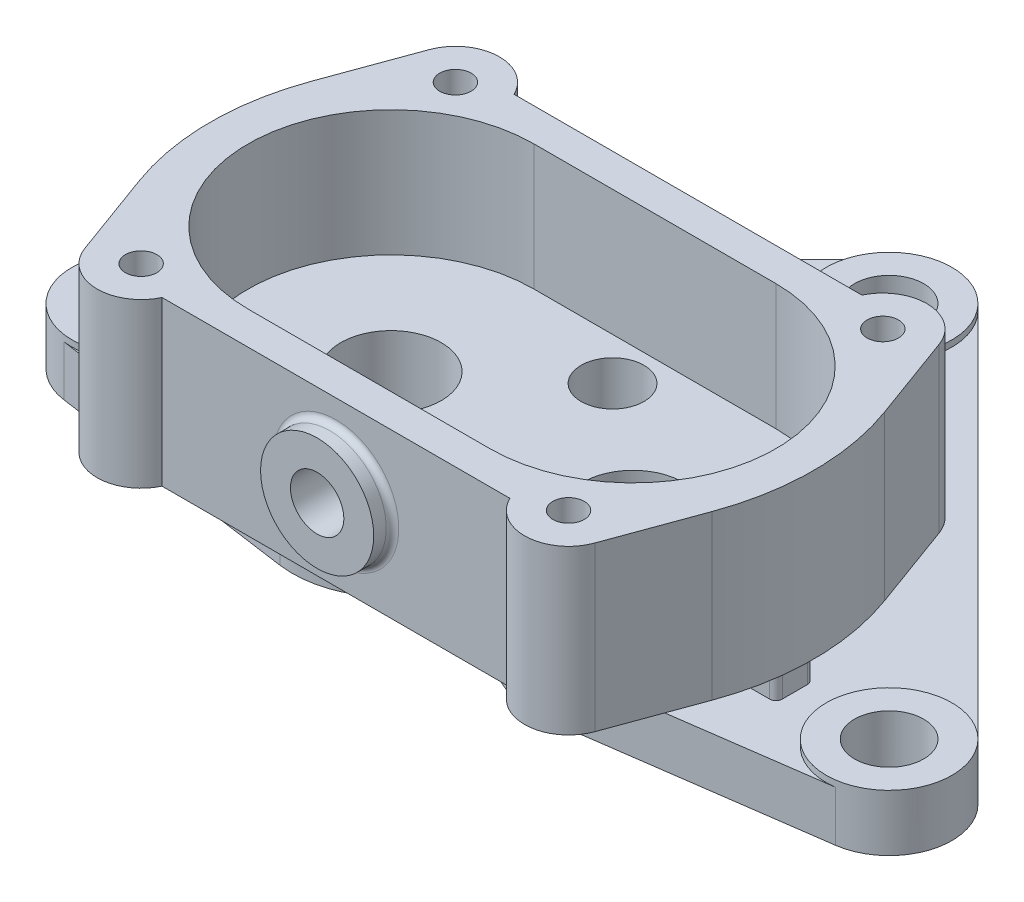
SolidWorks part; units mm, degrees
ref_plane "前视" through (0, 0, 0) normal (0, 0, 1) x (1, 0, 0)
ref_plane "上视" through (0, 0, 0) normal (0, 1, 0) x (1, 0, 0)
ref_plane "右视" through (0, 0, 0) normal (1, 0, 0) x (0, 0, -1)
sketch "草图1" plane through (0, 0, 0) normal (0, 1, 0) x (1, 0, 0)
  line L0 (0, 0) -> (0, 38.1176) construction
  line L1 (-67.0711, -52.9289) -> (-7.0711, 7.0711)
  line L2 (67.0711, -52.9289) -> (7.0711, 7.0711)
  line L3 (-61.3892, -69.903) -> (-21.4257, -75.5093)
  line L4 (61.3892, -69.903) -> (21.4257, -75.5093)
  line L5 (-60, -60) -> (51.3345, -60) construction
  circle A0 centre (0, 0) radius 5.5
  circle A1 centre (-60, -60) radius 5.5
  circle A2 centre (60, -60) radius 5.5
  arc A3 (7.0711, 7.0711) -> (-7.0711, 7.0711) centre (0, 0) ccw
  arc A4 (-67.0711, -52.9289) -> (-61.3892, -69.903) centre (-60, -60) ccw
  arc A5 (61.3892, -69.903) -> (67.0711, -52.9289) centre (60, -60) ccw
  arc A6 (-21.4257, -75.5093) -> (-3.9163, -63.1862) centre (-19.25, -60) ccw
  arc A7 (21.4257, -75.5093) -> (3.9163, -63.1862) centre (19.25, -60) cw
  arc A8 (-3.9163, -63.1862) -> (3.9163, -63.1862) centre (0, -64) cw
  circle A9 centre (-19.25, -60) radius 8
  circle A10 centre (19.25, -60) radius 8
  circle A11 centre (0, -44) radius 5
  dimension "D1" = 11
  dimension "D4" = 10
  dimension "D6" = 4
  dimension "D7" = 16
  dimension "D8" = 10
  dimension "D2" = 120
  dimension "D3" = 60
  dimension "D5" = 38.5
  dimension "D9" = 16
extrude "拉伸1" add sketch "草图1" along normal blind 8
sketch "草图2" plane through (0, 8, 0) normal (0, 1, 0) x (-1, 0, 0)
  circle A0 centre (0, 0) radius 10
  circle A1 centre (60, 60) radius 10
  circle A2 centre (-60, 60) radius 10
  circle A3 centre (-60, 60) radius 5.5 construction
  arc A4 (-61.3892, 69.903) -> (-67.0711, 52.9289) centre (-60, 60) ccw construction
  arc A5 (-7.0711, -7.0711) -> (7.0711, -7.0711) centre (0, 0) ccw construction
  circle A6 centre (60, 60) radius 5.5 construction
  arc A7 (67.0711, 52.9289) -> (61.3892, 69.903) centre (60, 60) ccw construction
  circle A8 centre (0, 0) radius 5.5 construction
  circle A9 centre (-60, 60) radius 5.5
  circle A10 centre (0, 0) radius 5.5
  circle A11 centre (60, 60) radius 5.5
extrude "拉伸2" add sketch "草图2" along normal blind 1
sketch "草图3" plane through (0, 8, 0) normal (0, 1, 0) x (-1, 0, 0)
  line L0 (45.6756, 60) -> (-44.8138, 60) construction
  line L1 (35.4239, 57) -> (44, 57)
  line L2 (35.4239, 63) -> (44, 63)
  line L3 (0, 0) -> (0, 17.1644) construction
  line L4 (0, 120) -> (0, 102.8356) construction
  line L5 (45, 58) -> (45, 62)
  line L6 (-35.4239, 63) -> (-44, 63)
  line L7 (-35.4239, 57) -> (-44, 57)
  line L8 (-45, 58) -> (-45, 62)
  arc A0 (16.3823, 44.6036) -> (34.4532, 56.2401) centre (19.25, 60) ccw
  arc A1 (-3.9163, 63.1862) -> (-34.4532, 63.7599) centre (-19.25, 60) ccw
  arc A2 (21.4257, 75.5093) -> (3.9163, 63.1862) centre (19.25, 60) ccw construction
  arc A3 (-3.9163, 63.1862) -> (-21.4257, 75.5093) centre (-19.25, 60) ccw construction
  arc A4 (-3.9163, 63.1862) -> (3.9163, 63.1862) centre (0, 64) ccw construction
  arc A5 (-3.9163, 63.1862) -> (3.9163, 63.1862) centre (0, 64) ccw
  circle A6 centre (19.25, 60) radius 8
  circle A7 centre (-19.25, 60) radius 8
  circle A8 centre (0, 44) radius 5
  arc A9 (-11.7374, 41.5034) -> (11.7374, 41.5034) centre (0, 44) ccw
  arc A10 (16.3823, 44.6036) -> (11.7374, 41.5034) centre (15.6499, 40.6712) ccw
  arc A11 (-16.3823, 44.6036) -> (-11.7374, 41.5034) centre (-15.6499, 40.6712) cw
  arc A12 (34.4532, 63.7599) -> (3.9163, 63.1862) centre (19.25, 60) ccw
  arc A13 (-34.4532, 56.2401) -> (-16.3823, 44.6036) centre (-19.25, 60) ccw
  arc A14 (45, 58) -> (44, 57) centre (44, 58) cw
  arc A15 (45, 62) -> (44, 63) centre (44, 62) ccw
  arc A16 (-45, 58) -> (-44, 57) centre (-44, 58) ccw
  arc A17 (-45, 62) -> (-44, 63) centre (-44, 62) cw
  arc A18 (-34.4532, 56.2401) -> (-35.4239, 57) centre (-35.4239, 56) ccw
  arc A19 (-34.4532, 63.7599) -> (-35.4239, 63) centre (-35.4239, 64) cw
  arc A20 (34.4532, 56.2401) -> (35.4239, 57) centre (35.4239, 56) cw
  arc A21 (34.4532, 63.7599) -> (35.4239, 63) centre (35.4239, 64) ccw
  point P38 (45, 57)
  point P41 (45, 63)
  point P44 (-45, 57)
  point P47 (-45, 63)
  point P50 (-34.6212, 57)
  point P53 (-34.6212, 63)
  point P56 (34.6212, 57)
  point P59 (34.6212, 63)
  dimension "D1" = 16
  dimension "D2" = 10
  dimension "D4" = 4
  dimension "D5" = 12
  dimension "D8" = 1
  dimension "D3" = 16
  dimension "D6" = 6
  dimension "D7" = 90
extrude "拉伸3" add sketch "草图3" along normal blind 6
sketch "草图4" plane through (0, 14, 0) normal (0, 1, 0) x (-1, 0, 0)
  line L0 (24.1305, 60) -> (-36.8421, 60) construction
  line L1 (-44, 57) -> (-35.4239, 57) construction
  line L2 (-35.4239, 63) -> (-44, 63) construction
  line L3 (45.5713, 46.2741) -> (40.575, 32.598)
  line L4 (45.5713, 73.7259) -> (40.575, 87.402)
  line L5 (0, 0) -> (0, 19.1495) construction
  line L6 (-45.5713, 73.7259) -> (-40.575, 87.402)
  line L7 (27.6754, 32) -> (-27.6754, 32)
  line L8 (27.6754, 88) -> (-27.6754, 88)
  line L9 (-45.5713, 46.2741) -> (-40.575, 32.598)
  arc A0 (45.5713, 46.2741) -> (45.5713, 73.7259) centre (8, 60) ccw
  arc A1 (-45.5713, 46.2741) -> (-45.5713, 73.7259) centre (-8, 60) cw
  circle A2 centre (0, 44) radius 5 construction
  circle A3 centre (-19.25, 60) radius 8 construction
  arc A4 (40.575, 87.402) -> (27.6754, 88) centre (34, 85) ccw
  arc A5 (-27.6754, 88) -> (-40.575, 87.402) centre (-34, 85) ccw
  arc A6 (-27.6754, 32) -> (-40.575, 32.598) centre (-34, 35) cw
  arc A7 (40.575, 32.598) -> (27.6754, 32) centre (34, 35) cw
  circle A8 centre (19.25, 60) radius 8 construction
  circle A9 centre (0, 44) radius 5
  circle A10 centre (-19.25, 60) radius 8
  circle A11 centre (19.25, 60) radius 8
  dimension "D4" = 40
  dimension "D5" = 7
  dimension "D1" = 56
  dimension "D2" = 50
  dimension "D3" = 68
  dimension "D6" = 16
extrude "拉伸4" add sketch "草图4" along normal blind 26
sketch "草图5" plane through (0, 40, 0) normal (0, 1, 0) x (-1, 0, 0)
  line L0 (19.25, 37.25) -> (-19.25, 37.25)
  line L1 (-19.25, 60) -> (19.25, 60) construction
  line L2 (19.25, 82.75) -> (-19.25, 82.75)
  arc A0 (19.25, 37.25) -> (19.25, 82.75) centre (19.25, 60) ccw
  arc A1 (-19.25, 82.75) -> (-19.25, 37.25) centre (-19.25, 60) ccw
  circle A2 centre (-19.25, 60) radius 8 construction
  circle A3 centre (19.25, 60) radius 8 construction
  dimension "D2" = 22.75
extrude "切除-拉伸1" cut sketch "草图5" against normal blind 20
sketch "草图6" plane through (0, 0, 88) normal (0, 0, 1) x (1, 0, 0)
  line L0 (0, 20) -> (0, 0) construction
  circle A0 centre (0, 27) radius 9
  dimension "D1" = 18
  dimension "D2" = 27
extrude "拉伸5" add sketch "草图6" along normal blind 3
hole_wizard "M10x1.5 螺纹孔1" positions "草图8" profile "草图7" tap size "M10x1.5" standard "ISO"
sketch "草图8" plane through (0, 0, 91) normal (0, 0, 1) x (1, 0, 0)
  point P0 (0, 27)
  dimension "D1" = 27
sketch "草图7" plane through (0, 27, 91) normal (1, 0, 0) x (0, -1, 0)
  line L0 (0, 0) -> (0, 10.8037)
  line L1 (0, 10.8037) -> (4.25, 8.25)
  line L2 (4.25, 8.25) -> (4.25, 0)
  line L5 (4.25, 0) -> (0, 0)
  line L10 (0, 10.8037) -> (-4.25, 8.25) construction
  line L11 (0, -6.35) -> (0, 107.95) construction
  dimension "螺纹孔钻头直径" = 8.5
  dimension "螺纹孔钻头深度" = 8.25
  dimension "导头角度" = 118
fillet "圆角1" radius 1
sketch "草图9" plane through (0, 0, 0) normal (1, 0, 0) x (0, 0, -1)
  line L0 (-12, 8) -> (-32, 36)
  line L1 (7.0711, 8) -> (-52.9289, 8) construction
  line L2 (-32, 40) -> (-32, 14) construction
  line L3 (-32, 8) -> (-32, 14) construction
  dimension "D1" = 20
  dimension "D2" = 28
rib "筋2" sketch "草图9" sketch "草图9" thickness 6 extrusion direction parallel to sketch draft on no parameters "D1"=6
sketch "草图10" plane through (0, 40, 0) normal (0, 1, 0) x (-1, 0, 0)
  line L0 (19.25, 60) -> (-19.25, 60) construction
  line L1 (0, 0) -> (0, 57.077) construction
  line L2 (0, 91) -> (0, 89) construction
  point P0 (34, 35)
  point P1 (34, 85)
  point P11 (-34, 35)
  point P12 (-34, 85)
  dimension "D1" = 50
  dimension "D2" = 68
hole_wizard "M6x1.0 螺纹孔1" positions "3D草图1" profile "草图11" tap size "M6x1.0" standard "ISO"
sketch3d "3D草图1"
  point P0 (-34, 40, 35)
  point P1 (34, 40, 35)
  point P2 (34, 40, 85)
  point P3 (-34, 40, 85)
sketch "草图11" plane through (-34, 40, 35) normal (1, 0, 0) x (0, 0, 1)
  line L0 (0, 0) -> (0, 10.5022)
  line L1 (0, 10.5022) -> (2.5, 9)
  line L2 (2.5, 9) -> (2.5, 0)
  line L5 (2.5, 0) -> (0, 0)
  line L10 (0, 10.5022) -> (-2.5, 9) construction
  line L11 (0, -6.35) -> (0, 107.95) construction
  dimension "螺纹孔钻头直径" = 5
  dimension "螺纹孔钻头深度" = 9
  dimension "导头角度" = 118
